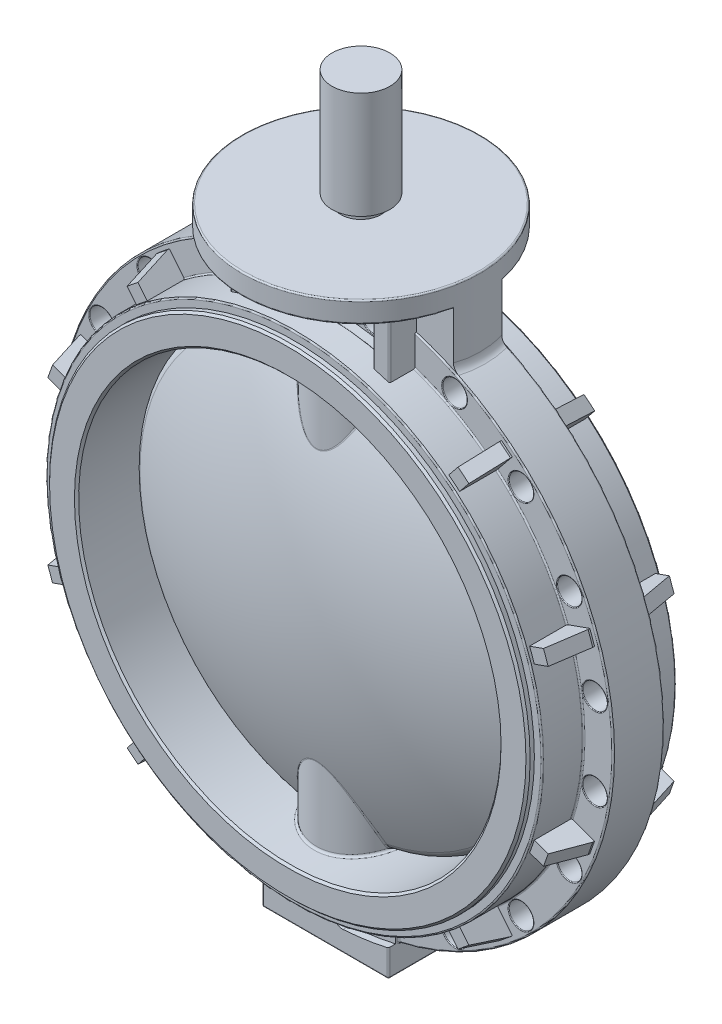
SolidWorks part; units mm, degrees
ref_plane "Front" through (0, 0, 0) normal (0, 0, 1) x (1, 0, 0)
ref_plane "Top" through (0, 0, 0) normal (0, 1, 0) x (1, 0, 0)
ref_plane "Right" through (0, 0, 0) normal (1, 0, 0) x (0, 0, -1)
sketch "Sketch1" plane through (0, 0, 0) normal (0, 0, 1) x (1, 0, 0)
  circle A0 centre (0, 0) radius 396.494
  circle A1 centre (0, 0) radius 330.2
  dimension "D1" = 792.988
  dimension "D2" = 660.4
extrude "Extrude1" add sketch "Sketch1" along normal mid plane 191
sketch "Sketch2" plane through (0, 0, 95.5) normal (0, 0, 1) x (1, 0, 0)
  circle A0 centre (0, 0) radius 354.33
  circle A1 centre (0, 0) radius 396.494 construction
  circle A2 centre (0, 0) radius 396.494
  dimension "D1" = 708.66
ref_plane "Plane1" through (0, 465.074, 0) normal (0, 1, 0) x (-1, 0, 0)
sketch "Sketch3" plane through (0, 465.074, 0) normal (0, 1, 0) x (-1, 0, 0)
  circle A0 centre (0, 0) radius 170.053
  dimension "D1" = 340.106
extrude "Extrude2" add sketch "Sketch3" against normal blind 30
ref_plane "Plane2" through (0, -423.926, 0) normal (0, 1, 0) x (-1, 0, 0)
sketch "Sketch6" plane through (0, 435.074, 0) normal (0, -1, 0) x (1, 0, 0)
  line L1 (0, 0) -> (0, -138.9352) construction
  line L2 (0, 0) -> (-336.2634, 0) construction
  line L4 (-88.9, -53.34) -> (88.9, -53.34)
  line L5 (-88.9, -53.34) -> (-88.9, 53.34)
  line L6 (-88.9, 53.34) -> (88.9, 53.34)
  line L7 (88.9, -53.34) -> (88.9, 53.34)
  dimension "D1" = 177.8
  dimension "D2" = 106.68
extrude "Extrude4" add sketch "Sketch6" along normal blind 101.6
extrude "Cut-Extrude1" cut sketch "Sketch2" against normal blind 59
mirror "Mirror1" about plane through (0, 0, 0) normal (0, 0, 1) of "Cut-Extrude1"
sketch "Sketch4" plane through (0, -423.926, 0) normal (0, 1, 0) x (-1, 0, 0)
  line L0 (90, 50.8) -> (90, -50.8)
  line L1 (-90, 50.8) -> (-90, -50.8)
  line L2 (0, 0) -> (0, 184.0621) construction
  line L3 (0, 0) -> (-322.6122, 0) construction
  line L4 (90, 50.8) -> (-90, 50.8)
  line L5 (90, -50.8) -> (-90, -50.8)
  dimension "D1" = 180
  dimension "D2" = 101.6
extrude "Extrude3" add sketch "Sketch4" along normal up to body separate body
sketch "Sketch13" plane through (0, 435.074, 0) normal (0, -1, 0) x (1, 0, 0)
  line L2 (-88.9, -53.34) -> (88.9, -53.34)
  line L3 (88.9, -53.34) -> (88.9, 53.34)
  line L4 (88.9, 53.34) -> (-88.9, 53.34)
  line L5 (-88.9, 53.34) -> (-88.9, -53.34)
extrude "Extrude5" add sketch "Sketch13" along normal up to body separate body
sketch "Sketch11" plane through (0, 0, 0) normal (0, 0, 1) x (1, 0, 0)
  line L0 (0, 0) -> (0, 424.0344) construction
  line L1 (58.6082, 370.0374) -> (0, 0) construction
  circle A0 centre (0, 0) radius 374.65 construction
  circle A1 centre (170.0875, 333.8156) radius 17.526
  circle A2 centre (264.9176, 264.9176) radius 17.526
  circle A3 centre (333.8156, 170.0875) radius 17.526
  circle A4 centre (370.0374, 58.6082) radius 17.526
  circle A5 centre (370.0374, -58.6082) radius 17.526
  circle A6 centre (333.8156, -170.0875) radius 17.526
  circle A7 centre (264.9176, -264.9176) radius 17.526
  circle A8 centre (170.0875, -333.8156) radius 17.526
  circle A9 centre (58.6082, -370.0374) radius 17.526
  circle A10 centre (58.6082, 370.0374) radius 17.526
  circle A11 centre (-58.6082, -370.0374) radius 17.526
  circle A12 centre (-170.0875, -333.8156) radius 17.526
  circle A13 centre (-264.9176, -264.9176) radius 17.526
  circle A14 centre (-333.8156, -170.0875) radius 17.526
  circle A15 centre (-370.0374, -58.6082) radius 17.526
  circle A16 centre (-370.0374, 58.6082) radius 17.526
  circle A17 centre (0, 0) radius 374.65 construction
  circle A18 centre (-333.8156, 170.0875) radius 17.526
  circle A19 centre (-264.9176, 264.9176) radius 17.526
  circle A20 centre (-170.0875, 333.8156) radius 17.526
  circle A21 centre (-58.6082, 370.0374) radius 17.526
  dimension "D1" = 749.3
  dimension "D2" = 35.052
  dimension "D3" = 9
extrude "Cut-Extrude3" cut sketch "Sketch11" against normal through all and the other way through all
fillet "Fillet1" radius 1 32 edges at (-187.6135, 333.8156, -36.5) (-152.5615, 333.8156, 36.5) (152.5615, 333.8156, -36.5) (187.6135, 333.8156, 36.5) (247.3916, 264.9176, -36.5) (282.4436, 264.9176, 36.5) (316.2896, 170.0875, -36.5) (351.3416, 170.0875, 36.5) (352.5114, 58.6082, -36.5) (387.5634, 58.6082, 36.5) (352.5114, -58.6082, -36.5) (387.5634, -58.6082, 36.5) (316.2896, -170.0875, -36.5) (351.3416, -170.0875, 36.5) (247.3916, -264.9176, -36.5) (282.4436, -264.9176, 36.5) (152.5615, -333.8156, -36.5) (187.6135, -333.8156, 36.5) (-187.6135, -333.8156, -36.5) (-152.5615, -333.8156, 36.5) (-282.4436, -264.9176, -36.5) (-247.3916, -264.9176, 36.5) (-351.3416, -170.0875, -36.5) (-316.2896, -170.0875, 36.5) (-387.5634, -58.6082, -36.5) (-352.5114, -58.6082, 36.5) (-387.5634, 58.6082, -36.5) (-352.5114, 58.6082, 36.5) (-351.3416, 170.0875, -36.5) (-316.2896, 170.0875, 36.5) (-282.4436, 264.9176, -36.5) (-247.3916, 264.9176, 36.5)
fillet "Fillet2" radius 2 10 edges at (-396.4936, 0.5646, -36.5) (396.4936, 0.5646, -36.5) (396.4936, 0.5646, 36.5) (-396.4936, 0.5646, 36.5) (354.33, 0, -95.5) (354.3295, 0.5684, -36.5) (-354.3295, 0.5684, -36.5) (354.3295, 0.5684, 36.5) (354.33, 0, 95.5) (-354.3295, 0.5684, 36.5)
sketch "Sketch14" plane through (0, 0, 0) normal (0, 0, 1) x (1, 0, 0)
  circle A0 centre (0, 0) radius 343.027
  circle A1 centre (0, 0) radius 301.498
  dimension "D1" = 602.996
  dimension "D2" = 686.054
extrude "Extrude6" add sketch "Sketch14" along normal mid plane 209.042
chamfer "Chamfer1" distance 3 angle 45 4 edges at (301.498, 0, -104.521) (343.027, 0, -104.521) (301.498, 0, 104.521) (343.027, 0, 104.521)
sketch "Sketch15" plane through (0, 435.074, 0) normal (0, -1, 0) x (1, 0, 0)
  line L0 (-166.5166, -34.5) -> (-90.0049, -34.5)
  line L1 (0, 0) -> (-180.8671, 0) construction
  line L2 (0, 0) -> (0, -176.9462) construction
  line L3 (-88.9, -34.5) -> (-396.494, -34.5) construction
  line L4 (166.5166, -34.5) -> (90.0049, -34.5)
  line L5 (166.5166, 34.5) -> (90.0049, 34.5)
  line L6 (-166.5166, 34.5) -> (-90.0049, 34.5)
  line L8 (-90.0049, -34.5) -> (-90.0049, 34.5)
  line L9 (90.0049, -34.5) -> (90.0049, 34.5)
  arc A1 (166.5166, -34.5) -> (166.5166, 34.5) centre (0, 0) ccw
  arc A2 (-166.5166, 34.5) -> (-166.5166, -34.5) centre (0, 0) ccw
extrude "Extrude7" add sketch "Sketch15" along normal up to surface (48.9307 mm away)
sketch "Sketch16" plane through (0, 0, 53.34) normal (0, 0, 1) x (1, 0, 0)
  line L0 (-10.0562, 382.0358) -> (-10.0562, 354.3715)
  line L1 (0.8277, 0) -> (0.8277, 503.7981) construction
  line L2 (0.8277, 0) -> (-446.4511, 0) construction
  line L3 (-88.9, 342.9964) -> (-88.9, 435.074) construction
  line L4 (-88.9, 342.9964) -> (-88.9, 385.1493)
  line L5 (90.5555, 342.9964) -> (90.5555, 385.1493)
  line L6 (11.7116, 382.0358) -> (11.7116, 354.3715)
  line L7 (11.7116, -382.0358) -> (11.7116, -354.3715)
  line L8 (90.5555, -342.9964) -> (90.5555, -385.1493)
  line L9 (-88.9, -342.9964) -> (-88.9, -385.1493)
  line L10 (-10.0562, -382.0358) -> (-10.0562, -354.3715)
  line L11 (-88.9, 435.074) -> (-89.696, 404.1537)
  line L13 (-166.5166, 435.074) -> (166.5166, 435.074) construction
  line L14 (-88.9, 435.074) -> (-10.0562, 435.074)
  line L15 (-10.0562, 411.9622) -> (-10.0562, 435.074)
  line L16 (90.5555, 435.074) -> (91.3515, 404.1537)
  line L17 (90.5555, 435.074) -> (11.7116, 435.074)
  line L18 (11.7116, 411.9622) -> (11.7116, 435.074)
  arc A1 (-10.0562, 382.0358) -> (-23.5387, 394.7117) centre (-22.7562, 382.0358) ccw
  arc A2 (25.1941, 394.7117) -> (90.5555, 385.1493) centre (0.8277, 0) cw
  arc A3 (-10.0562, 354.3715) -> (-88.9, 342.9964) centre (0.8277, 0) ccw
  arc A4 (-23.5387, 394.7117) -> (-88.9, 385.1493) centre (0.8277, 0) ccw
  arc A5 (11.7116, 354.3715) -> (90.5555, 342.9964) centre (0.8277, 0) cw
  arc A6 (11.7116, 382.0358) -> (25.1941, 394.7117) centre (24.4116, 382.0358) cw
  arc A7 (11.7116, -382.0358) -> (25.1941, -394.7117) centre (24.4116, -382.0358) ccw
  arc A8 (11.7116, -354.3715) -> (90.5555, -342.9964) centre (0.8277, 0) ccw
  arc A9 (-23.5387, -394.7117) -> (-88.9, -385.1493) centre (0.8277, 0) cw
  arc A10 (-10.0562, -354.3715) -> (-88.9, -342.9964) centre (0.8277, 0) cw
  arc A11 (25.1941, -394.7117) -> (90.5555, -385.1493) centre (0.8277, 0) ccw
  arc A12 (-10.0562, -382.0358) -> (-23.5387, -394.7117) centre (-22.7562, -382.0358) cw
  arc A13 (-17.3342, 404.3498) -> (-80.5466, 396.4932) centre (0.8277, 0) ccw
  arc A14 (-10.0562, 411.9622) -> (-17.3342, 404.3498) centre (-17.6762, 411.9622) cw
  arc A15 (-80.5466, 396.4932) -> (-89.696, 404.1537) centre (-82.0785, 403.9576) cw
  arc A16 (18.9897, 404.3498) -> (82.202, 396.4932) centre (0.8277, 0) cw
  arc A17 (82.202, 396.4932) -> (91.3515, 404.1537) centre (83.734, 403.9576) ccw
  arc A18 (11.7116, 411.9622) -> (18.9897, 404.3498) centre (19.3316, 411.9622) ccw
  point P39 (-89.9459, 394.4475)
  dimension "D1" = 12.7
  dimension "D4" = 7.62
  dimension "D2" = 40.64
  dimension "D3" = 21.7678
extrude "Cut-Extrude4" cut sketch "Sketch16" against normal blind 12.7
mirror "Mirror2" about plane through (0, 0, 0) normal (0, 0, 1) of "Cut-Extrude4"
fillet "Fillet3" radius 1 8 edges at (41.0822, -370.0374, -40.64) (76.1342, -370.0374, 40.64) (-76.1342, -370.0374, 40.64) (-41.0822, -370.0374, -40.64) (41.0822, 370.0374, 40.64) (76.1342, 370.0374, -40.64) (-76.1342, 370.0374, -40.64) (-41.0822, 370.0374, 40.64)
fillet "Fillet8" radius 12.7 2 edges at (-169.1539, 358.6007, -17.4641) (169.1539, 358.6007, 17.4641)
fillet "Fillet10" radius 2 11 edges at (90, -423.926, 0) (0, -423.926, -50.8) (-90, -423.926, 0) (0, -423.926, 50.8) (90, -404.6021, -50.8) (90, -404.6021, 50.8) (-90, -383.3177, -50.8) (-90, -383.3177, 50.8) (0, 435.074, -170.053) (0, 435.074, 170.053) (0, 465.074, 170.053)
sketch "Sketch17" plane through (0, 0, 40.64) normal (0, 0, 1) x (1, 0, 0)
  line L0 (-98.3441, -340.3859) -> (-98.3441, -382.8263)
  line L1 (-80.3073, -345.13) -> (-80.3073, -387.0506)
  arc A0 (-88.9, -385.1493) -> (-23.5387, -394.7117) centre (0.8277, 0) ccw construction
  arc A1 (-88.9, -342.9964) -> (-10.0562, -354.3715) centre (0.8277, 0) ccw construction
  arc A2 (-98.3441, -382.8263) -> (-80.3073, -387.0506) centre (0.8277, 0) ccw
  arc A3 (-98.3441, -340.3859) -> (-80.3073, -345.13) centre (0.8277, 0) ccw
extrude "Cut-Extrude7" cut sketch "Sketch17" along normal through all
mirror "Mirror3" about plane through (0, 0, 0) normal (0, 0, 1) of "Cut-Extrude7"
sketch "Sketch18" plane through (0, 435.074, 0) normal (0, -1, 0) x (1, 0, 0)
  line L0 (-90.0049, -34.5) -> (-90.0049, 72.8816)
  line L1 (-90.0049, -34.5) -> (-90.0049, -72.8816)
  line L2 (0, 0) -> (-107.6956, 0) construction
  line L3 (-90.0049, -72.8816) -> (-113.5586, -72.8816)
  line L4 (-113.5586, -72.8816) -> (-113.5586, 72.8816)
  line L5 (-113.5586, 72.8816) -> (-90.0049, 72.8816)
  line L6 (0, 0) -> (0, 187.0685) construction
  line L7 (113.5586, 72.8816) -> (90.0049, 72.8816)
  line L8 (113.5586, -72.8816) -> (113.5586, 72.8816)
  line L9 (90.0049, -72.8816) -> (113.5586, -72.8816)
  line L10 (90.0049, -34.5) -> (90.0049, -72.8816)
  line L11 (90.0049, -34.5) -> (90.0049, 72.8816)
extrude "Extrude8" add sketch "Sketch18" along normal up to next
fillet "Fillet12" radius 2 16 edges at (113.5586, 385.357, 72.8816) (90.0049, 388.8911, 72.8816) (-90.0049, 388.8911, 72.8816) (-113.5586, 385.357, 72.8816) (-113.5586, 385.357, -72.8816) (-90.0049, 388.8911, -72.8816) (90.0049, 388.8911, -72.8816) (113.5586, 385.357, -72.8816) (-88.9, 364.0729, -40.64) (-88.9, 417.8179, -40.64) (88.9, 364.4782, -40.64) (88.9, 416.7151, -40.64) (88.9, 416.7151, 40.64) (88.9, 364.4782, 40.64) (-88.9, 364.0729, 40.64) (-88.9, 417.8179, 40.64)
fillet "Fillet13" radius 2 18 edges at (-90, -342.7094, -39.57) (-90, -343.4521, -36.9646) (-90, -364.4337, -36.5) (-90, -385.7142, -35.7249) (-90, -342.7094, 39.57) (-90, -343.1376, 37.2813) (-90, -364.4337, 36.5) (-90, -385.4001, 36.0408) (-90, -386.1444, 0) (90, -342.7094, 44.65) (90, -343.4521, 36.9646) (90, -364.4337, 36.5) (90, -385.7142, 35.7249) (90, -342.7094, -44.65) (90, -343.1376, -37.2813) (90, -364.4337, -36.5) (90, -385.4001, -36.0408) (90, -386.1444, 0)
sketch "Sketch20" plane through (0, 0, 36.5) normal (0, 0, 1) x (1, 0, 0)
  line L0 (0, 0) -> (-422.3686, 0) construction
  line L1 (0, 0) -> (0, -454.1016) construction
  line L2 (0, 0) -> (260.9022, 322.1873) construction
  line L3 (236.9588, 308.5019) -> (252.4938, 295.9219)
  line L4 (252.4938, 295.9219) -> (227.8773, 265.523)
  line L5 (227.8773, 265.523) -> (212.3423, 278.103)
  line L6 (212.3423, 278.103) -> (236.9588, 308.5019)
  line L7 (-212.3423, 278.103) -> (-236.9588, 308.5019)
  line L8 (-227.8773, 265.523) -> (-212.3423, 278.103)
  line L9 (-252.4938, 295.9219) -> (-227.8773, 265.523)
  line L10 (-236.9588, 308.5019) -> (-252.4938, 295.9219)
  line L11 (-236.9588, -308.5019) -> (-252.4938, -295.9219)
  line L12 (-252.4938, -295.9219) -> (-227.8773, -265.523)
  line L13 (-227.8773, -265.523) -> (-212.3423, -278.103)
  line L14 (-212.3423, -278.103) -> (-236.9588, -308.5019)
  line L15 (212.3423, -278.103) -> (236.9588, -308.5019)
  line L16 (227.8773, -265.523) -> (212.3423, -278.103)
  line L17 (252.4938, -295.9219) -> (227.8773, -265.523)
  line L18 (236.9588, -308.5019) -> (252.4938, -295.9219)
  line L19 (0, 0) -> (422.8099, 0) construction
  line L20 (0, 0) -> (404.6258, 143.2855) construction
  line L21 (326.36, 126.1732) -> (363.2324, 139.2304)
  line L22 (333.0328, 107.33) -> (369.9051, 120.3872)
  line L23 (363.2324, 139.2304) -> (369.9051, 120.3872)
  line L24 (326.36, 126.1732) -> (333.0328, 107.33)
  line L25 (326.36, -126.1732) -> (333.0328, -107.33)
  line L26 (363.2324, -139.2304) -> (369.9051, -120.3872)
  line L27 (333.0328, -107.33) -> (369.9051, -120.3872)
  line L28 (326.36, -126.1732) -> (363.2324, -139.2304)
  line L29 (-326.36, -126.1732) -> (-363.2324, -139.2304)
  line L30 (-333.0328, -107.33) -> (-369.9051, -120.3872)
  line L31 (-363.2324, -139.2304) -> (-369.9051, -120.3872)
  line L32 (-326.36, -126.1732) -> (-333.0328, -107.33)
  line L33 (-326.36, 126.1732) -> (-333.0328, 107.33)
  line L34 (-363.2324, 139.2304) -> (-369.9051, 120.3872)
  line L35 (-333.0328, 107.33) -> (-369.9051, 120.3872)
  line L36 (-326.36, 126.1732) -> (-363.2324, 139.2304)
  dimension "D1" = 39
  dimension "D2" = 19.9898
  dimension "D3" = 19.5
  dimension "D4" = 19.9898
  dimension "D5" = 39.116
  dimension "D6" = 349.758
  dimension "D7" = 349.758
extrude "Extrude9" add sketch "Sketch20" along normal blind 53.34
mirror "Mirror4" about plane through (0, 0, 0) normal (0, 0, 1) of "Extrude9"
chamfer "Chamfer2" distance 50.8 angle 15 8 edges at (-244.7263, 302.2119, 89.84) (244.7263, 302.2119, 89.84) (366.5688, 129.8088, 89.84) (366.5688, -129.8088, 89.84) (244.7263, -302.2119, 89.84) (-244.7263, -302.2119, 89.84) (-366.5688, -129.8088, 89.84) (-366.5688, 129.8088, 89.84)
chamfer "Chamfer3" distance 50.8 angle 15 8 edges at (366.5688, -129.8088, -89.84) (-244.7263, -302.2119, -89.84) (-366.5688, -129.8088, -89.84) (-366.5688, 129.8088, -89.84) (-244.7263, 302.2119, -89.84) (244.7263, 302.2119, -89.84) (366.5688, 129.8088, -89.84) (244.7263, -302.2119, -89.84)
sketch "Sketch21" plane through (0, 0, 0) normal (0, 1, 0) x (1, 0, 0)
  circle A0 centre (0, 0) radius 63.5
  dimension "D1" = 127
extrude "Extrude10" add sketch "Sketch21" along normal up to next and the other way up to next
sketch "Sketch22" plane through (0, 0, 0) normal (0, 1, 0) x (1, 0, 0)
  line L0 (0, 0) -> (0, 195.1799) construction
  line L1 (0, 0) -> (411.1452, 0) construction
  line L2 (0, 0) -> (0, -180.4353) construction
  line L3 (301.498, 7.7655) -> (301.498, -7.7655)
  line L4 (0, 92.8848) -> (0, -92.8848)
  arc A0 (291.7079, 23.6491) -> (0, 92.8848) centre (0, -556.2538) ccw
  arc A1 (291.7079, -23.6491) -> (0, -92.8848) centre (0, 556.2538) cw
  arc A2 (301.498, 7.7655) -> (291.7079, 23.6491) centre (283.718, 7.7655) ccw
  arc A3 (291.7079, -23.6491) -> (301.498, -7.7655) centre (283.718, -7.7655) ccw
  point P14 (301.498, 18.62)
  dimension "D2" = 17.78
  dimension "D1" = 301.498
revolve "Revolve1" add sketch "Sketch22" angle 360 about L0
fillet "Fillet14" radius 3.175 16 edges at (8.034, -301.3909, -62.9897) (8.034, -301.3909, -62.9897) (-8.034, 301.3909, -62.9897) (-8.034, 301.3909, -62.9897) (-60.7729, -291.6965, -18.4095) (-3.4, -193.3584, -63.4089) (60.6082, -291.3058, -18.9446) (-60.6082, 291.3058, -18.9446) (3.4, 193.3584, -63.4089) (60.7729, 291.6965, -18.4095) (-62.0992, -294.1427, 13.2642) (3.4, -193.3584, 63.4089) (61.5764, -293.3287, 15.5111) (-61.5764, 293.3287, 15.5111) (-3.4, 193.3584, 63.4089) (62.0992, 294.1427, 13.2642)
sketch "Sketch23" plane through (0, 465.074, 0) normal (0, 1, 0) x (1, 0, 0)
  circle A0 centre (0, 0) radius 28.575
  dimension "D1" = 57.15
extrude "Extrude11" add sketch "Sketch23" along normal blind 12.7
sketch "Sketch24" plane through (0, 477.774, 0) normal (0, 1, 0) x (1, 0, 0)
  circle A0 centre (0, 0) radius 41.275
  dimension "D1" = 82.55
extrude "Extrude12" add sketch "Sketch24" along normal blind 152.4
